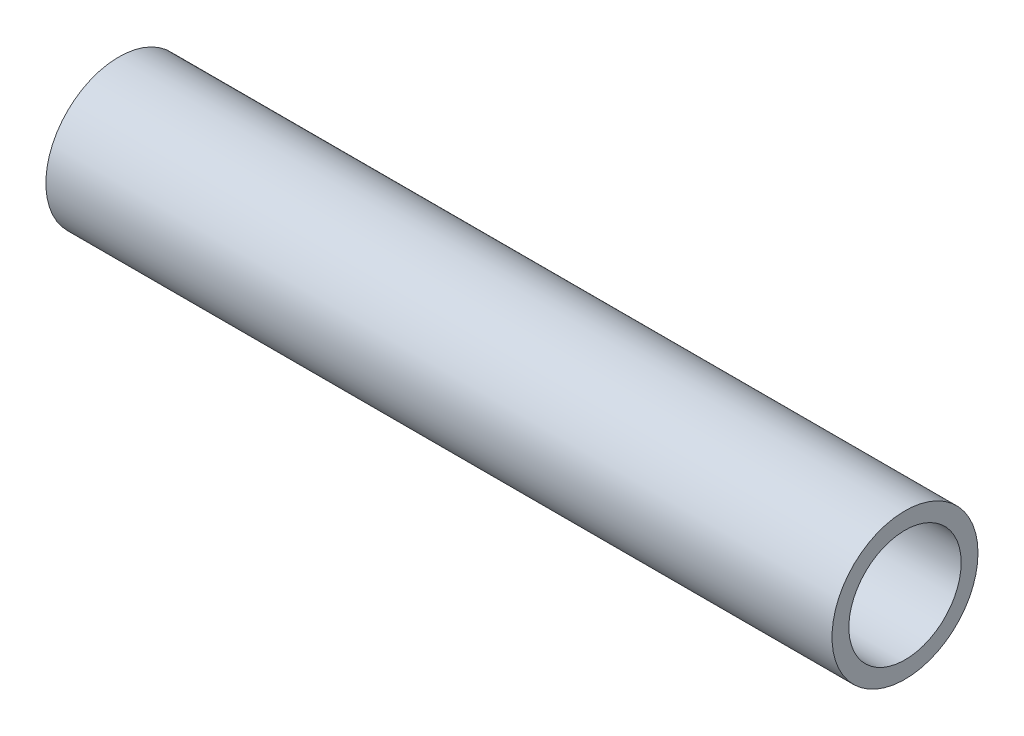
SolidWorks part; units mm, degrees
ref_plane "Front" through (0, 0, 0) normal (0, 0, 1) x (1, 0, 0)
ref_plane "Top" through (0, 0, 0) normal (0, 1, 0) x (1, 0, 0)
ref_plane "Right" through (0, 0, 0) normal (1, 0, 0) x (0, 0, -1)
sketch "Sketch1" plane through (0, 0, 0) normal (0, 0, 1) x (1, 0, 0)
  line L0 (0, 0) -> (177.8, 0)
  line L1 (9.9848, 0) -> (-9.9848, 0) construction
  dimension "D1" = 177.8
other "Structural Member1"
ref_plane "Plane1" through (0, 0, 0) normal (1, 0, 0) x (0, 0, -1)
sketch "Sketch11" plane through (0, 0, 0) normal (1, 0, 0) x (0, 0, -1)
  circle A0 centre (0, 0) radius 12.7
  circle A1 centre (0, 0) radius 16.51
  point P3 (0, 0)
  dimension "D1" = 33.02
  dimension "D2" = 25.4
